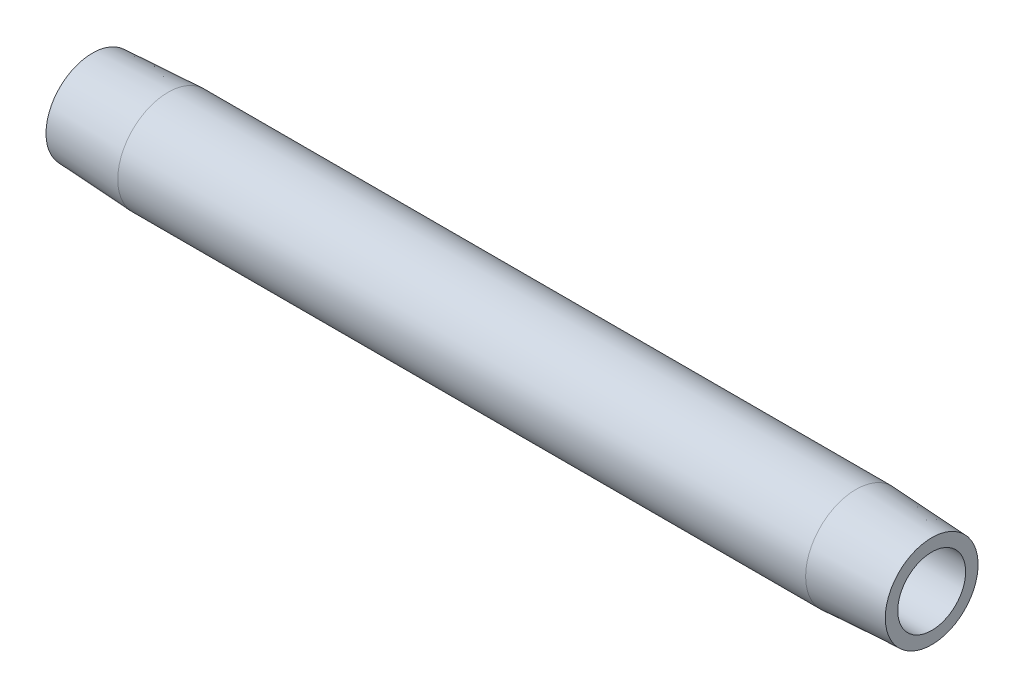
SolidWorks part; units mm, degrees
ref_plane "Front Plane" through (0, 0, 0) normal (0, 0, 1) x (1, 0, 0)
ref_plane "Top Plane" through (0, 0, 0) normal (0, 1, 0) x (1, 0, 0)
ref_plane "Right Plane" through (0, 0, 0) normal (1, 0, 0) x (0, 0, -1)
sketch "Sketch1" plane through (0, 0, 0) normal (0, 1, 0) x (1, 0, 0)
  line L6 (114.3, 4.6228) -> (0, 4.6228)
  line L7 (10.3124, 6.858) -> (0, 6.3175)
  line L8 (0, 6.3175) -> (0, 4.6228)
  line L9 (103.9876, 6.858) -> (10.3124, 6.858)
  line L10 (114.3, 6.3175) -> (103.9876, 6.858)
  line L11 (114.3, 4.6228) -> (114.3, 6.3175)
  line L12 (-6.376, 0) -> (49993.624, 0) construction
  dimension "D1" = 9.2456
  dimension "D2" = 13.716
  dimension "D3" = 3
  dimension "D4" = 3
  dimension "D5" = 114.3
  dimension "D6" = 10.3124
  dimension "D7" = 10.3124
revolve "Revolve1" add sketch "Sketch1" angle 360 about L12
